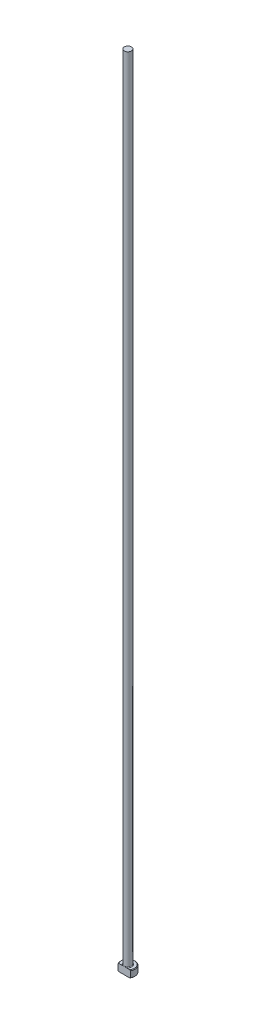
SolidWorks part; units mm, degrees
ref_plane "Front Plane" through (0, 0, 0) normal (0, 0, 1) x (1, 0, 0)
ref_plane "Top Plane" through (0, 0, 0) normal (0, 1, 0) x (1, 0, 0)
ref_plane "Right Plane" through (0, 0, 0) normal (1, 0, 0) x (0, 0, -1)
sketch "Sketch1" plane through (0, 0, 0) normal (0, 0, 1) x (1, 0, 0)
  line L0 (0, 259.9588) -> (0, -15.1925) construction
  line L1 (0, 0) -> (-3.175, 0)
  line L2 (-3.175, 0) -> (-3.175, 3.175)
  line L3 (-3.175, 3.175) -> (-1.5875, 3.175)
  line L4 (-1.5875, 3.175) -> (-1.5875, 355.6)
  line L5 (-1.5875, 355.6) -> (0, 355.6)
  line L6 (0, 355.6) -> (0, 0)
  dimension "L" = 355.6
  dimension "H" = 6.35
  dimension "T" = 3.175
  dimension "D" = 3.175
revolve "Revolve1" add sketch "Sketch1" angle 360 about L0
chamfer "Chamfer1" distance 0.254 angle 45 2 edges at (0, 3.175, 3.175) (0, 0, 3.175)
fillet "Fillet1" radius 0.254 1 edges at (0, 3.175, 1.5875)
sketch "Sketch2" plane through (0, 0, 0) normal (0, 1, 0) x (1, 0, 0)
  line L0 (-2.7496, -1.5875) -> (2.7496, -1.5875)
  circle A0 centre (0, 0) radius 3.175 construction
  arc A1 (-2.7496, -1.5875) -> (2.7496, -1.5875) centre (0, 0) ccw
  circle A3 centre (0, 0) radius 1.5875 construction
  dimension "D1" = 0
extrude "Key" cut sketch "Sketch2" along normal through all
sketch "Pocket Sketch" plane through (0, 0, 0) normal (0, 0, 1) x (1, 0, 0)
  line L0 (-3.5719, 0) -> (-3.5719, 3.2004)
  line L1 (-3.5719, 3.2004) -> (-2.5479, 3.2004)
  line L2 (-1.7859, 3.9624) -> (-1.7859, 22.225)
  line L3 (-1.7859, 22.225) -> (0, 22.225)
  line L4 (0, 22.225) -> (0, 0)
  line L5 (0, 0) -> (-3.5719, 0)
  line L6 (0, 12.6104) -> (0, -2.4989) construction
  line L7 (-3.175, 2.921) -> (-3.175, 0.254) construction
  line L8 (2.921, 3.175) -> (-2.921, 3.175) construction
  line L9 (-1.5875, 355.6) -> (-1.5875, 3.429) construction
  line L10 (-2.5479, 3.2004) -> (-1.7859, 3.9624)
  point P3 (-1.7859, 3.2004)
  dimension "D1" = 7.1437
  dimension "D2" = 0.3969
  dimension "D3" = 0.0254
  dimension "D4" = 0.1984
  dimension "D5" = 3.5719
  dimension "D6" = 22.225
